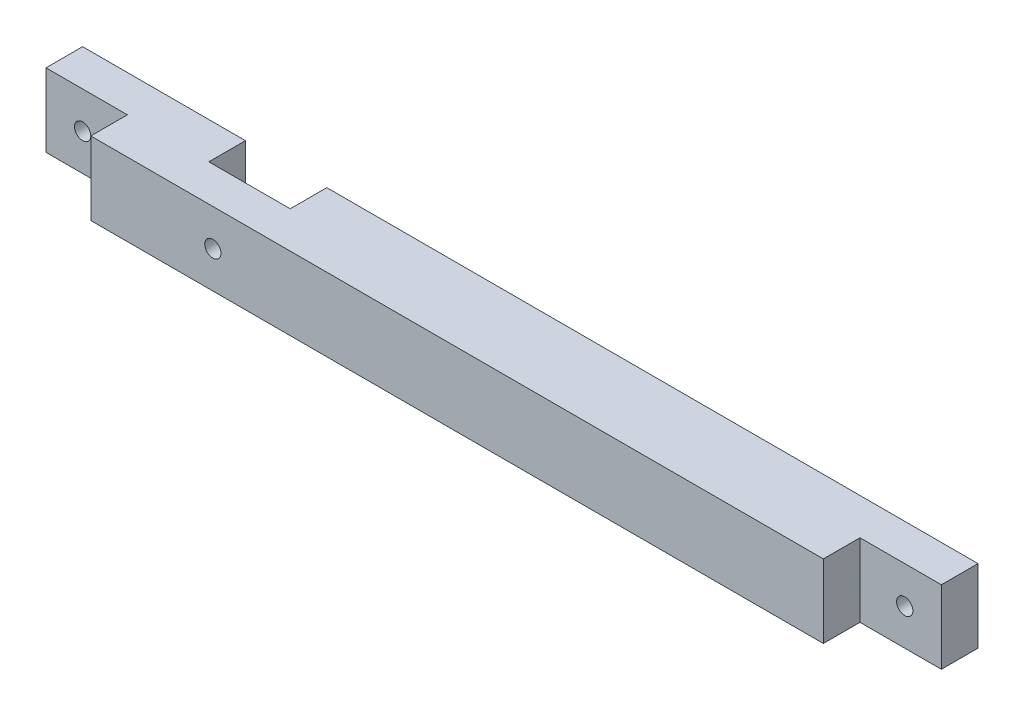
SolidWorks part; units mm, degrees
ref_plane "Face" through (0, 0, 0) normal (0, 0, 1) x (1, 0, 0)
ref_plane "Dessus" through (0, 0, 0) normal (0, 1, 0) x (1, 0, 0)
ref_plane "Droite" through (0, 0, 0) normal (1, 0, 0) x (0, 0, -1)
sketch "Esquisse1" plane through (0, 0, 0) normal (0, 0, 1) x (1, 0, 0)
  line L1 (-67.2717, -109.6176) -> (42.7283, -109.6176)
  line L2 (-67.2717, -109.6176) -> (-67.2717, -100.6176)
  line L3 (-67.2717, -100.6176) -> (42.7283, -100.6176)
  line L4 (42.7283, -109.6176) -> (42.7283, -100.6176)
  dimension "D1" = 110
  dimension "D2" = 9
extrude "Extrusion1" add sketch "Esquisse1" along normal blind 9
sketch "Esquisse2" plane through (0, 0, 9) normal (0, 0, 1) x (1, 0, 0)
  line L0 (42.7283, -100.6176) -> (-67.2717, -100.6176) construction
  line L1 (-67.2717, -109.6176) -> (-57.2717, -109.6176)
  line L2 (-67.2717, -109.6176) -> (-67.2717, -100.6176)
  line L3 (-67.2717, -100.6176) -> (-57.2717, -100.6176)
  line L4 (-57.2717, -109.6176) -> (-57.2717, -100.6176)
  line L6 (42.7283, -109.6176) -> (32.7283, -109.6176)
  line L7 (42.7283, -109.6176) -> (42.7283, -100.6176)
  line L8 (42.7283, -100.6176) -> (32.7283, -100.6176)
  line L9 (32.7283, -109.6176) -> (32.7283, -100.6176)
  dimension "D1" = 10
  dimension "D2" = 10
extrude "Enlèv. mat.-Extru.1" cut sketch "Esquisse2" against normal blind 4.5
sketch "Esquisse4" plane through (0, 0, 4.5) normal (0, 0, 1) x (1, 0, 0)
  line L0 (42.7283, -109.6176) -> (42.7283, -100.6176) construction
  line L1 (32.7283, -109.6176) -> (42.7283, -109.6176) construction
  circle A0 centre (38.2284, -105.1454) radius 1
  point P2 (42.7283, -105.1176)
  point P5 (37.7283, -109.6176)
  dimension "D3" = 2
  dimension "D1" = 4.5
  dimension "D2" = 4.5
extrude "Enlèv. mat.-Extru.2" cut sketch "Esquisse4" against normal blind 4.5
sketch "Esquisse5" plane through (0, 0, 4.5) normal (0, 0, 1) x (1, 0, 0)
  line L0 (-67.2717, -109.6176) -> (-57.2717, -109.6176) construction
  line L1 (-67.2717, -100.6176) -> (-67.2717, -109.6176) construction
  circle A0 centre (-62.7717, -105.1176) radius 1
  dimension "D1" = 2
  dimension "D2" = 4.5
  dimension "D3" = 4.5
extrude "Enlèv. mat.-Extru.3" cut sketch "Esquisse5" against normal blind 4.5
sketch "Esquisse6" plane through (0, 0, 0) normal (0, 0, -1) x (-1, 0, 0)
  line L0 (-42.7283, -100.6176) -> (67.2717, -100.6176) construction
  line L1 (47.2717, -100.6176) -> (37.2717, -100.6176)
  line L2 (47.2717, -100.6176) -> (47.2717, -109.6176)
  line L3 (47.2717, -109.6176) -> (37.2717, -109.6176)
  line L4 (37.2717, -100.6176) -> (37.2717, -109.6176)
  line L5 (67.2717, -109.6176) -> (-42.7283, -109.6176) construction
  dimension "D1" = 20
  dimension "D2" = 10
extrude "Enlèv. mat.-Extru.4" cut sketch "Esquisse6" against normal blind 4.5
sketch "Esquisse7" plane through (0, 0, 4.5) normal (0, 0, -1) x (-1, 0, 0)
  line L0 (47.2717, -100.6176) -> (37.2717, -109.6176) construction
  line L1 (37.2717, -109.6176) -> (37.2717, -100.6176) construction
  line L2 (37.2717, -100.6176) -> (47.2717, -109.6176) construction
  circle A0 centre (42.2717, -105.1176) radius 1
  dimension "D1" = 2
extrude "Enlèv. mat.-Extru.5" cut sketch "Esquisse7" against normal blind 4.5
